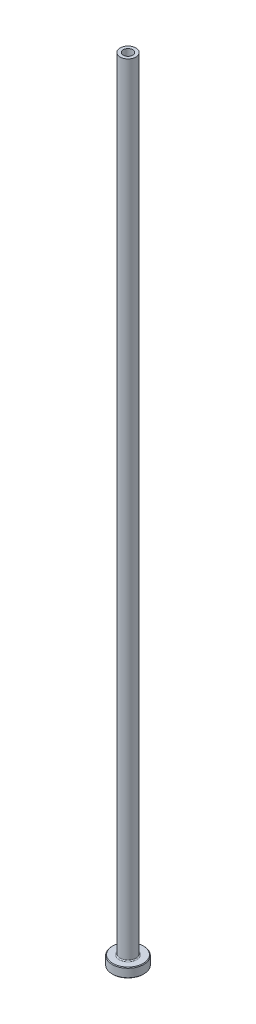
SolidWorks part; units mm, degrees
ref_plane "Front Plane" through (0, 0, 0) normal (0, 0, 1) x (1, 0, 0)
ref_plane "Top Plane" through (0, 0, 0) normal (0, 1, 0) x (1, 0, 0)
ref_plane "Right Plane" through (0, 0, 0) normal (1, 0, 0) x (0, 0, -1)
sketch "Sketch1" plane through (0, 0, 0) normal (0, 0, 1) x (1, 0, 0)
  line L0 (-1.5, 250) -> (-2.5, 250)
  line L1 (-2.5, 250) -> (-2.5, 3)
  line L2 (-2.5, 3) -> (-5, 3)
  line L3 (-5, 3) -> (-5, 0)
  line L4 (5.5, 0) -> (-5.5, 0) construction
  line L5 (-5, 0) -> (-1.75, 0)
  line L6 (-1.5, 205) -> (-1.5, 250)
  line L7 (0, 92.1877) -> (0, -15.5353) construction
  line L8 (0, -5.5) -> (0, 5.5) construction
  line L9 (-1.5, 205) -> (-1.75, 193)
  line L10 (-1.75, 193) -> (-1.75, 0)
  dimension "D1" = 0.25
  dimension "ID" = 3
  dimension "OD" = 5
  dimension "L" = 250
  dimension "H" = 10
  dimension "T" = 3
  dimension "N" = 45
  dimension "D2" = 12
revolve "Revolve1" add sketch "Sketch1" angle 360 about L7
fillet "Fillet1" radius 0.3 1 edges at (0, 3, 2.5)
chamfer "Chamfer1" distance 0.2 angle 45 2 edges at (0, 3, 5) (0, 0, 5)
chamfer "Chamfer3" distance 0.5 angle 45 1 edges at (0, 0, 1.75)
